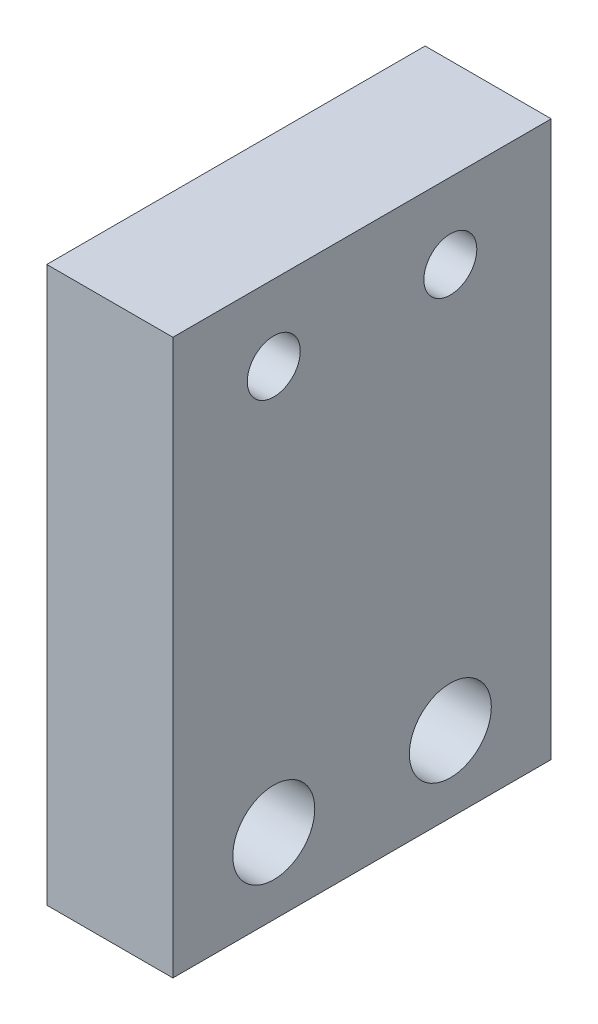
SolidWorks part; units mm, degrees
ref_plane "前视基准面" through (0, 0, 0) normal (0, 0, 1) x (1, 0, 0)
ref_plane "上视基准面" through (0, 0, 0) normal (0, 1, 0) x (1, 0, 0)
ref_plane "右视基准面" through (0, 0, 0) normal (1, 0, 0) x (0, 0, -1)
sketch "草图1" plane through (0, 0, 0) normal (0, 0, 1) x (1, 0, 0)
  line L0 (0, 0) -> (10, 0)
  line L1 (0, 44) -> (10, 44)
  line L2 (10, 0) -> (10, 44)
  line L3 (0, 0) -> (0, 44)
extrude "凸台-拉伸1" add sketch "草图1" along normal blind 30
sketch "草图2" plane through (10, 0, 0) normal (1, 0, 0) x (0, 0, -1)
  circle A0 centre (-22, 6) radius 3.25
  circle A1 centre (-8, 6) radius 3.25
  circle A2 centre (-22, 38) radius 2.1
  circle A3 centre (-8, 38) radius 2.1
extrude "切除-拉伸1" cut sketch "草图2" against normal blind 30
sketch "草图3" plane through (10, 0, 0) normal (1, 0, 0) x (0, 0, -1)
  circle A0 centre (-22, 6) radius 5.5 construction
  circle A1 centre (-8, 6) radius 5.5 construction
sketch "草图4" plane through (0, 0, 0) normal (-1, 0, 0) x (0, 0, 1)
  circle A0 centre (8, 6) radius 5.5
  circle A1 centre (22, 6) radius 5.5
extrude "切除-拉伸2" cut sketch "草图4" against normal blind 4.5
